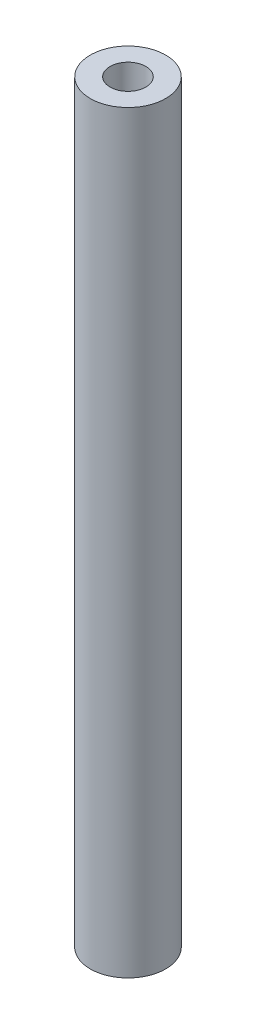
SolidWorks part; units mm, degrees
ref_plane "Ebene vorne" through (0, 0, 0) normal (0, 0, 1) x (1, 0, 0)
ref_plane "Ebene oben" through (0, 0, 0) normal (0, 1, 0) x (1, 0, 0)
ref_plane "Ebene rechts" through (0, 0, 0) normal (1, 0, 0) x (0, 0, -1)
sketch "Skizze1" plane through (0, 0, 0) normal (0, 1, 0) x (1, 0, 0)
  circle A0 centre (0, 0) radius 2
  circle A1 centre (0, 0) radius 0.95
  dimension "D1" = 1.9
  dimension "D2" = 4
extrude "Aufsatz-Linear austragen1" add sketch "Skizze1" along normal mid plane 40
